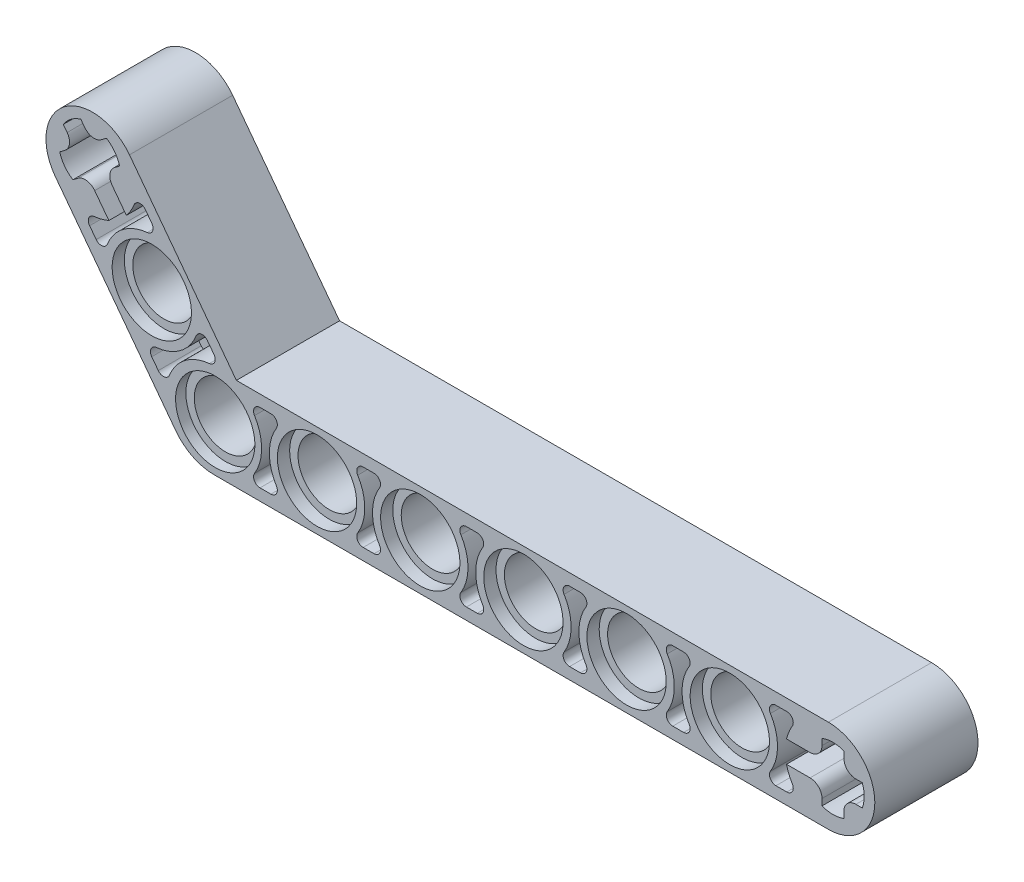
SolidWorks part; units mm, degrees
ref_plane "정면" through (0, 0, 0) normal (0, 0, 1) x (1, 0, 0)
ref_plane "윗면" through (0, 0, 0) normal (0, 1, 0) x (1, 0, 0)
ref_plane "우측면" through (0, 0, 0) normal (1, 0, 0) x (0, 0, -1)
ref_plane "평면1" through (0, 0, 3.925) normal (0, 0, 1) x (1, 0, 0)
sketch "스케치1" plane through (0, 0, 3.925) normal (0, 0, 1) x (1, 0, 0)
  line L0 (47.6452, 3.6) -> (1.745, 3.6)
  line L1 (1.745, 3.6) -> (-6.5436, 14.5993)
  line L2 (-12.2937, 10.2663) -> (-1.8448, -3.6)
  line L3 (-1.8448, -3.6) -> (47.6452, -3.6)
  arc A0 (-6.5436, 14.5993) -> (-12.2937, 10.2663) centre (-9.4187, 12.4328) ccw
  arc A1 (47.6452, -3.6) -> (47.6452, 3.6) centre (47.6452, 0) ccw
  dimension "D5" = 1.8448
  dimension "D1" = 7.2
  dimension "D2" = 7.2
  dimension "D3" = 49.49
  dimension "D4" = 45.9002
extrude "보스-돌출1" add sketch "스케치1" against normal blind 8
sketch "스케치2" plane through (0, 0, 3.925) normal (0, 0, 1) x (1, 0, 0)
  line L0 (48.85, -2.2712) -> (48.85, -0.85)
  line L1 (48.85, -0.85) -> (50.2712, -0.85)
  line L2 (50.2712, 0.85) -> (48.85, 0.85)
  line L3 (48.85, 0.85) -> (48.85, 2.2712)
  line L4 (47.15, 2.2712) -> (47.15, 0.85)
  line L5 (47.15, 0.85) -> (44.399, 0.85)
  line L6 (44.4223, 2.7) -> (43.5777, 2.7)
  line L7 (43.5777, -2.7) -> (44.4223, -2.7)
  line L8 (44.399, -0.85) -> (47.15, -0.85)
  line L9 (47.15, -0.85) -> (47.15, -2.2712)
  arc A0 (47.15, -2.2712) -> (48.85, -2.2712) centre (48, 0) ccw
  arc A1 (50.2712, -0.85) -> (50.2712, 0.85) centre (48, 0) ccw
  arc A2 (48.85, 2.2712) -> (47.15, 2.2712) centre (48, 0) ccw
  arc A3 (44.399, 0.85) -> (44.8482, 1.9381) centre (48, 0) cw
  arc A4 (44.8482, 1.9381) -> (44.4223, 2.7) centre (44.4223, 2.2) ccw
  arc A5 (43.5777, 2.7) -> (43.1518, 1.9381) centre (43.5777, 2.2) ccw
  arc A6 (43.1518, 1.9381) -> (43.1518, -1.9381) centre (40, 0) cw
  arc A7 (43.1518, -1.9381) -> (43.5777, -2.7) centre (43.5777, -2.2) ccw
  arc A8 (44.4223, -2.7) -> (44.8482, -1.9381) centre (44.4223, -2.2) ccw
  arc A9 (44.8482, -1.9381) -> (44.399, -0.85) centre (48, 0) cw
extrude "컷-돌출1" cut sketch "스케치2" against normal through all
sketch "스케치3" plane through (0, 0, -4.075) normal (0, 0, -1) x (-1, 0, 0)
  line L0 (5.3196, 11.5458) -> (4.8113, 10.8713)
  line L1 (9.124, 7.6215) -> (9.6322, 8.296)
  line L2 (8.1407, 9.3907) -> (9.7963, 11.5878)
  line L3 (9.7963, 11.5878) -> (10.9313, 10.7325)
  line L4 (11.9544, 12.0902) -> (10.8194, 12.9455)
  line L5 (10.8194, 12.9455) -> (11.6747, 14.0804)
  line L6 (10.317, 15.1035) -> (9.4617, 13.9686)
  line L7 (9.4617, 13.9686) -> (8.3268, 14.8238)
  line L8 (7.3037, 13.4661) -> (8.4387, 12.6109)
  line L9 (8.4387, 12.6109) -> (6.783, 10.4138)
  arc A0 (6.783, 10.4138) -> (6.1844, 11.4274) centre (9.629, 12.7782) cw
  arc A1 (6.1844, 11.4274) -> (5.3196, 11.5458) centre (5.7189, 11.2449) ccw
  arc A2 (4.8113, 10.8713) -> (5.1635, 10.0726) centre (5.2106, 10.5704) ccw
  arc A3 (5.1635, 10.0726) -> (8.2591, 7.7398) centre (4.8145, 6.3891) cw
  arc A4 (8.2591, 7.7398) -> (9.124, 7.6215) centre (8.7246, 7.9224) ccw
  arc A5 (9.6322, 8.296) -> (9.2801, 9.0947) centre (9.2329, 8.5969) ccw
  arc A6 (9.2801, 9.0947) -> (8.1407, 9.3907) centre (9.629, 12.7782) cw
  arc A7 (10.9313, 10.7325) -> (11.9544, 12.0902) centre (9.629, 12.7782) ccw
  arc A8 (11.6747, 14.0804) -> (10.317, 15.1035) centre (9.629, 12.7782) ccw
  arc A9 (8.3268, 14.8238) -> (7.3037, 13.4661) centre (9.629, 12.7782) ccw
extrude "컷-돌출2" cut sketch "스케치3" against normal through all
sketch "스케치4" plane through (0, 0, 3.925) normal (0, 0, 1) x (1, 0, 0)
  line L0 (-4.8177, 1.9069) -> (-4.3094, 1.2324)
  line L1 (0.0032, 4.4822) -> (-0.5051, 5.1567)
  arc A0 (-4.3094, 1.2324) -> (-3.4446, 1.3508) centre (-3.9101, 1.5333) ccw
  arc A1 (-3.4446, 1.3508) -> (-0.349, 3.6835) centre (0, 0) cw
  arc A2 (-0.349, 3.6835) -> (0.0032, 4.4822) centre (-0.3961, 4.1813) ccw
  arc A3 (-0.5051, 5.1567) -> (-1.3699, 5.0383) centre (-0.9044, 4.8558) ccw
  arc A4 (-1.3699, 5.0383) -> (-4.4656, 2.7056) centre (-4.8145, 6.3891) cw
  arc A5 (-4.4656, 2.7056) -> (-4.8177, 1.9069) centre (-4.4184, 2.2078) ccw
extrude "컷-돌출3" cut sketch "스케치4" against normal blind 3.325
sketch "스케치5" plane through (0, 0, 3.925) normal (0, 0, 1) x (1, 0, 0)
  line L0 (11.5777, -2.7) -> (12.4223, -2.7)
  line L1 (12.4223, 2.7) -> (11.5777, 2.7)
  arc A0 (12.4223, -2.7) -> (12.8482, -1.9381) centre (12.4223, -2.2) ccw
  arc A1 (12.8482, -1.9381) -> (12.8482, 1.9381) centre (16, 0) cw
  arc A2 (12.8482, 1.9381) -> (12.4223, 2.7) centre (12.4223, 2.2) ccw
  arc A3 (11.5777, 2.7) -> (11.1518, 1.9381) centre (11.5777, 2.2) ccw
  arc A4 (11.1518, 1.9381) -> (11.1518, -1.9381) centre (8, 0) cw
  arc A5 (11.1518, -1.9381) -> (11.5777, -2.7) centre (11.5777, -2.2) ccw
extrude "컷-돌출4" cut sketch "스케치5" against normal blind 3.325
sketch "스케치6" plane through (0, 0, 3.925) normal (0, 0, 1) x (1, 0, 0)
  line L0 (3.5777, -2.7) -> (4.4223, -2.7)
  line L1 (4.4223, 2.7) -> (3.5777, 2.7)
  arc A0 (4.4223, -2.7) -> (4.8482, -1.9381) centre (4.4223, -2.2) ccw
  arc A1 (4.8482, -1.9381) -> (4.8482, 1.9381) centre (8, 0) cw
  arc A2 (4.8482, 1.9381) -> (4.4223, 2.7) centre (4.4223, 2.2) ccw
  arc A3 (3.5777, 2.7) -> (3.1518, 1.9381) centre (3.5777, 2.2) ccw
  arc A4 (3.1518, 1.9381) -> (3.1518, -1.9381) centre (0, 0) cw
  arc A5 (3.1518, -1.9381) -> (3.5777, -2.7) centre (3.5777, -2.2) ccw
extrude "컷-돌출5" cut sketch "스케치6" against normal blind 3.325
sketch "스케치7" plane through (0, 0, 3.925) normal (0, 0, 1) x (1, 0, 0)
  line L0 (19.5777, -2.7) -> (20.4223, -2.7)
  line L1 (20.4223, 2.7) -> (19.5777, 2.7)
  arc A0 (20.4223, -2.7) -> (20.8482, -1.9381) centre (20.4223, -2.2) ccw
  arc A1 (20.8482, -1.9381) -> (20.8482, 1.9381) centre (24, 0) cw
  arc A2 (20.8482, 1.9381) -> (20.4223, 2.7) centre (20.4223, 2.2) ccw
  arc A3 (19.5777, 2.7) -> (19.1518, 1.9381) centre (19.5777, 2.2) ccw
  arc A4 (19.1518, 1.9381) -> (19.1518, -1.9381) centre (16, 0) cw
  arc A5 (19.1518, -1.9381) -> (19.5777, -2.7) centre (19.5777, -2.2) ccw
extrude "컷-돌출6" cut sketch "스케치7" against normal blind 3.325
sketch "스케치8" plane through (0, 0, 3.925) normal (0, 0, 1) x (1, 0, 0)
  line L0 (27.5777, -2.7) -> (28.4223, -2.7)
  line L1 (28.4223, 2.7) -> (27.5777, 2.7)
  arc A0 (28.4223, -2.7) -> (28.8482, -1.9381) centre (28.4223, -2.2) ccw
  arc A1 (28.8482, -1.9381) -> (28.8482, 1.9381) centre (32, 0) cw
  arc A2 (28.8482, 1.9381) -> (28.4223, 2.7) centre (28.4223, 2.2) ccw
  arc A3 (27.5777, 2.7) -> (27.1518, 1.9381) centre (27.5777, 2.2) ccw
  arc A4 (27.1518, 1.9381) -> (27.1518, -1.9381) centre (24, 0) cw
  arc A5 (27.1518, -1.9381) -> (27.5777, -2.7) centre (27.5777, -2.2) ccw
extrude "컷-돌출7" cut sketch "스케치8" against normal blind 3.325
sketch "스케치9" plane through (0, 0, 3.925) normal (0, 0, 1) x (1, 0, 0)
  line L0 (35.5777, -2.7) -> (36.4223, -2.7)
  line L1 (36.4223, 2.7) -> (35.5777, 2.7)
  arc A0 (36.4223, -2.7) -> (36.8482, -1.9381) centre (36.4223, -2.2) ccw
  arc A1 (36.8482, -1.9381) -> (36.8482, 1.9381) centre (40, 0) cw
  arc A2 (36.8482, 1.9381) -> (36.4223, 2.7) centre (36.4223, 2.2) ccw
  arc A3 (35.5777, 2.7) -> (35.1518, 1.9381) centre (35.5777, 2.2) ccw
  arc A4 (35.1518, 1.9381) -> (35.1518, -1.9381) centre (32, 0) cw
  arc A5 (35.1518, -1.9381) -> (35.5777, -2.7) centre (35.5777, -2.2) ccw
extrude "컷-돌출8" cut sketch "스케치9" against normal blind 3.325
sketch "스케치10" plane through (0, 0, -4.075) normal (0, 0, -1) x (-1, 0, 0)
  line L0 (0.5051, 5.1567) -> (-0.0032, 4.4822)
  line L1 (4.3094, 1.2324) -> (4.8177, 1.9069)
  arc A0 (-0.0032, 4.4822) -> (0.349, 3.6835) centre (0.3961, 4.1813) ccw
  arc A1 (0.349, 3.6835) -> (3.4446, 1.3508) centre (0, 0) cw
  arc A2 (3.4446, 1.3508) -> (4.3094, 1.2324) centre (3.9101, 1.5333) ccw
  arc A3 (4.8177, 1.9069) -> (4.4656, 2.7056) centre (4.4184, 2.2078) ccw
  arc A4 (4.4656, 2.7056) -> (1.3699, 5.0383) centre (4.8145, 6.3891) cw
  arc A5 (1.3699, 5.0383) -> (0.5051, 5.1567) centre (0.9044, 4.8558) ccw
extrude "컷-돌출9" cut sketch "스케치10" against normal blind 3.325
sketch "스케치11" plane through (0, 0, -4.075) normal (0, 0, -1) x (-1, 0, 0)
  line L0 (-12.4223, -2.7) -> (-11.5777, -2.7)
  line L1 (-11.5777, 2.7) -> (-12.4223, 2.7)
  arc A0 (-12.4223, 2.7) -> (-12.8482, 1.9381) centre (-12.4223, 2.2) ccw
  arc A1 (-12.8482, 1.9381) -> (-12.8482, -1.9381) centre (-16, 0) cw
  arc A2 (-12.8482, -1.9381) -> (-12.4223, -2.7) centre (-12.4223, -2.2) ccw
  arc A3 (-11.5777, -2.7) -> (-11.1518, -1.9381) centre (-11.5777, -2.2) ccw
  arc A4 (-11.1518, -1.9381) -> (-11.1518, 1.9381) centre (-8, 0) cw
  arc A5 (-11.1518, 1.9381) -> (-11.5777, 2.7) centre (-11.5777, 2.2) ccw
extrude "컷-돌출10" cut sketch "스케치11" against normal blind 3.325
sketch "스케치12" plane through (0, 0, -4.075) normal (0, 0, -1) x (-1, 0, 0)
  line L0 (-4.4223, -2.7) -> (-3.5777, -2.7)
  line L1 (-3.5777, 2.7) -> (-4.4223, 2.7)
  arc A0 (-4.4223, 2.7) -> (-4.8482, 1.9381) centre (-4.4223, 2.2) ccw
  arc A1 (-4.8482, 1.9381) -> (-4.8482, -1.9381) centre (-8, 0) cw
  arc A2 (-4.8482, -1.9381) -> (-4.4223, -2.7) centre (-4.4223, -2.2) ccw
  arc A3 (-3.5777, -2.7) -> (-3.1518, -1.9381) centre (-3.5777, -2.2) ccw
  arc A4 (-3.1518, -1.9381) -> (-3.1518, 1.9381) centre (0, 0) cw
  arc A5 (-3.1518, 1.9381) -> (-3.5777, 2.7) centre (-3.5777, 2.2) ccw
extrude "컷-돌출11" cut sketch "스케치12" against normal blind 3.325
sketch "스케치13" plane through (0, 0, -4.075) normal (0, 0, -1) x (-1, 0, 0)
  line L0 (-20.4223, -2.7) -> (-19.5777, -2.7)
  line L1 (-19.5777, 2.7) -> (-20.4223, 2.7)
  arc A0 (-20.4223, 2.7) -> (-20.8482, 1.9381) centre (-20.4223, 2.2) ccw
  arc A1 (-20.8482, 1.9381) -> (-20.8482, -1.9381) centre (-24, 0) cw
  arc A2 (-20.8482, -1.9381) -> (-20.4223, -2.7) centre (-20.4223, -2.2) ccw
  arc A3 (-19.5777, -2.7) -> (-19.1518, -1.9381) centre (-19.5777, -2.2) ccw
  arc A4 (-19.1518, -1.9381) -> (-19.1518, 1.9381) centre (-16, 0) cw
  arc A5 (-19.1518, 1.9381) -> (-19.5777, 2.7) centre (-19.5777, 2.2) ccw
extrude "컷-돌출12" cut sketch "스케치13" against normal blind 3.325
sketch "스케치14" plane through (0, 0, -4.075) normal (0, 0, -1) x (-1, 0, 0)
  line L0 (-28.4223, -2.7) -> (-27.5777, -2.7)
  line L1 (-27.5777, 2.7) -> (-28.4223, 2.7)
  arc A0 (-28.4223, 2.7) -> (-28.8482, 1.9381) centre (-28.4223, 2.2) ccw
  arc A1 (-28.8482, 1.9381) -> (-28.8482, -1.9381) centre (-32, 0) cw
  arc A2 (-28.8482, -1.9381) -> (-28.4223, -2.7) centre (-28.4223, -2.2) ccw
  arc A3 (-27.5777, -2.7) -> (-27.1518, -1.9381) centre (-27.5777, -2.2) ccw
  arc A4 (-27.1518, -1.9381) -> (-27.1518, 1.9381) centre (-24, 0) cw
  arc A5 (-27.1518, 1.9381) -> (-27.5777, 2.7) centre (-27.5777, 2.2) ccw
extrude "컷-돌출13" cut sketch "스케치14" against normal blind 3.325
sketch "스케치15" plane through (0, 0, -4.075) normal (0, 0, -1) x (-1, 0, 0)
  line L0 (-36.4223, -2.7) -> (-35.5777, -2.7)
  line L1 (-35.5777, 2.7) -> (-36.4223, 2.7)
  arc A0 (-36.4223, 2.7) -> (-36.8482, 1.9381) centre (-36.4223, 2.2) ccw
  arc A1 (-36.8482, 1.9381) -> (-36.8482, -1.9381) centre (-40, 0) cw
  arc A2 (-36.8482, -1.9381) -> (-36.4223, -2.7) centre (-36.4223, -2.2) ccw
  arc A3 (-35.5777, -2.7) -> (-35.1518, -1.9381) centre (-35.5777, -2.2) ccw
  arc A4 (-35.1518, -1.9381) -> (-35.1518, 1.9381) centre (-32, 0) cw
  arc A5 (-35.1518, 1.9381) -> (-35.5777, 2.7) centre (-35.5777, 2.2) ccw
extrude "컷-돌출14" cut sketch "스케치15" against normal blind 3.325
ref_plane "평면2" through (0, 0, 0) normal (0, -1, 0) x (1, 0, 0)
sketch "스케치16" plane through (0, 0, 0) normal (0, -1, 0) x (1, 0, 0)
  line L0 (3.1789, 3.925) -> (0.1039, 3.925)
  line L1 (0.1039, 3.925) -> (0.1039, -4.075)
  line L2 (0.1039, -4.075) -> (3.1789, -4.075)
  line L3 (3.1789, -4.075) -> (3.1789, -3.125)
  line L4 (3.1789, -3.125) -> (2.5289, -3.125)
  line L5 (2.5289, -3.125) -> (2.5289, 3.125)
  line L6 (2.5289, 3.125) -> (3.1789, 3.125)
  line L7 (3.1789, 3.125) -> (3.1789, 3.925)
  line L8 (0.1039, 3.925) -> (0.1039, -4.075) construction
  point P8 (0.1039, -4.075)
revolve "컷-회전1" cut sketch "스케치16" angle 360 about L8
sketch "스케치17" plane through (0, 0, 0) normal (0, -1, 0) x (1, 0, 0)
  line L0 (11.075, 3.925) -> (8, 3.925)
  line L1 (8, 3.925) -> (8, -4.075)
  line L2 (8, -4.075) -> (11.075, -4.075)
  line L3 (11.075, -4.075) -> (11.075, -3.275)
  line L4 (11.075, -3.275) -> (10.425, -3.275)
  line L5 (10.425, -3.275) -> (10.425, 2.975)
  line L6 (10.425, 2.975) -> (11.075, 2.975)
  line L7 (11.075, 2.975) -> (11.075, 3.925)
  line L8 (8, 3.925) -> (8, -4.075) construction
  line L9 (-1.8448, -4.075) -> (47.6452, -4.075) construction
  line L10 (55, 3.925) -> (-55, 3.925) construction
  point P8 (0, 0)
revolve "컷-회전2" cut sketch "스케치17" angle 360 about L8
sketch "스케치18" plane through (0, 0, 0) normal (0, -1, 0) x (1, 0, 0)
  line L0 (19.075, 3.925) -> (16, 3.925)
  line L1 (16, 3.925) -> (16, -4.075)
  line L2 (16, -4.075) -> (19.075, -4.075)
  line L3 (19.075, -4.075) -> (19.075, -3.275)
  line L4 (19.075, -3.275) -> (18.425, -3.275)
  line L5 (18.425, -3.275) -> (18.425, 2.975)
  line L6 (18.425, 2.975) -> (19.075, 2.975)
  line L7 (19.075, 2.975) -> (19.075, 3.925)
  line L8 (16, 3.925) -> (16, -4.075) construction
  line L9 (-1.8448, -4.075) -> (47.6452, -4.075) construction
  line L10 (55, 3.925) -> (-55, 3.925) construction
revolve "컷-회전3" cut sketch "스케치18" angle 360 about L8
sketch "스케치19" plane through (0, 0, 0) normal (0, -1, 0) x (1, 0, 0)
  line L0 (27.075, 3.925) -> (24, 3.925)
  line L1 (24, 3.925) -> (24, -4.075)
  line L2 (24, -4.075) -> (27.075, -4.075)
  line L3 (27.075, -4.075) -> (27.075, -3.275)
  line L4 (27.075, -3.275) -> (26.425, -3.275)
  line L5 (26.425, -3.275) -> (26.425, 2.975)
  line L6 (26.425, 2.975) -> (27.075, 2.975)
  line L7 (27.075, 2.975) -> (27.075, 3.925)
  line L8 (24, 3.925) -> (24, -4.075) construction
  line L9 (-1.8448, -4.075) -> (47.6452, -4.075) construction
  line L10 (55, 3.925) -> (-55, 3.925) construction
revolve "컷-회전4" cut sketch "스케치19" angle 360 about L8
sketch "스케치20" plane through (0, 0, 0) normal (0, -1, 0) x (1, 0, 0)
  line L0 (35.075, 3.925) -> (32, 3.925)
  line L1 (32, 3.925) -> (32, -4.075)
  line L2 (32, -4.075) -> (35.075, -4.075)
  line L3 (35.075, -4.075) -> (35.075, -3.275)
  line L4 (35.075, -3.275) -> (34.425, -3.275)
  line L5 (34.425, -3.275) -> (34.425, 2.975)
  line L6 (34.425, 2.975) -> (35.075, 2.975)
  line L7 (35.075, 2.975) -> (35.075, 3.925)
  line L8 (32, 3.925) -> (32, -4.075) construction
  line L9 (-1.8448, -4.075) -> (47.6452, -4.075) construction
  line L10 (55, 3.925) -> (-55, 3.925) construction
revolve "컷-회전5" cut sketch "스케치20" angle 360 about L8
sketch "스케치21" plane through (0, 0, 0) normal (0, -1, 0) x (1, 0, 0)
  line L0 (43.075, 3.925) -> (40, 3.925)
  line L1 (40, 3.925) -> (40, -4.075)
  line L2 (40, -4.075) -> (43.075, -4.075)
  line L3 (43.075, -4.075) -> (43.075, -3.275)
  line L4 (43.075, -3.275) -> (42.425, -3.275)
  line L5 (42.425, -3.275) -> (42.425, 2.975)
  line L6 (42.425, 2.975) -> (43.075, 2.975)
  line L7 (43.075, 2.975) -> (43.075, 3.925)
  line L8 (40, 3.925) -> (40, -4.075) construction
  line L9 (-1.8448, -4.075) -> (47.6452, -4.075) construction
  line L10 (55, 3.925) -> (-55, 3.925) construction
revolve "컷-회전6" cut sketch "스케치21" angle 360 about L8
ref_plane "평면3" through (0, 6.3891, 0) normal (0, -1, 0) x (1, 0, 0)
sketch "스케치22" plane through (0, 6.3891, 0) normal (0, -1, 0) x (1, 0, 0)
  line L0 (-1.7395, 3.925) -> (-4.8145, 3.925)
  line L1 (-4.8145, 3.925) -> (-4.8145, -4.075)
  line L2 (-4.8145, -4.075) -> (-1.7395, -4.075)
  line L3 (-1.7395, -4.075) -> (-1.7395, -3.275)
  line L4 (-1.7395, -3.275) -> (-2.3895, -3.275)
  line L5 (-2.3895, -3.275) -> (-2.3895, 2.975)
  line L6 (-2.3895, 2.975) -> (-1.7395, 2.975)
  line L7 (-1.7395, 2.975) -> (-1.7395, 3.925)
  line L8 (-4.8145, 3.925) -> (-4.8145, -4.075) construction
  line L9 (-12.2937, -4.075) -> (-1.8448, -4.075) construction
  line L10 (55, 3.925) -> (-55, 3.925) construction
revolve "컷-회전7" cut sketch "스케치22" angle 360 about L8
fillet "필렛1" radius 0.9244 8 edges at (-10.8194, 12.9455, -0.075) (47.15, 0.85, -0.075) (-8.4387, 12.6109, -0.075) (48.85, 0.85, -0.075) (-9.4617, 13.9686, -0.075) (47.15, -0.85, -0.075) (48.85, -0.85, -0.075) (-9.7963, 11.5878, -0.075)
fillet "필렛2" radius 3.7 1 edges at (-1.8448, -3.6, -0.075)
